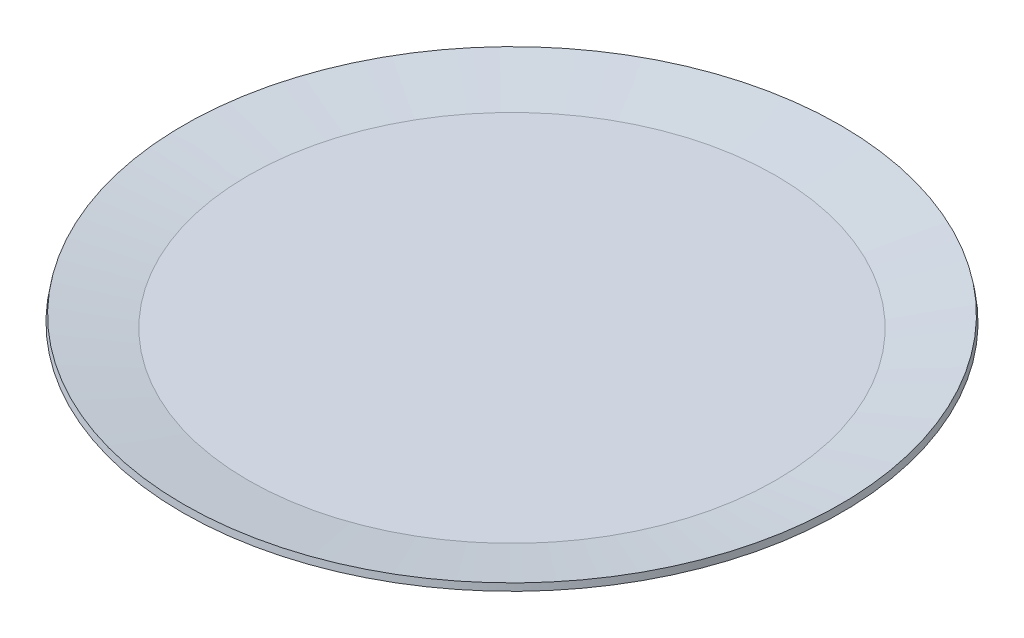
SolidWorks part; units mm, degrees
ref_plane "Front Plane" through (0, 0, 0) normal (0, 0, 1) x (1, 0, 0)
ref_plane "Top Plane" through (0, 0, 0) normal (0, 1, 0) x (1, 0, 0)
ref_plane "Right Plane" through (0, 0, 0) normal (1, 0, 0) x (0, 0, -1)
sketch "Sketch2" plane through (0, 0, 0) normal (0, 0, 1) x (1, 0, 0)
  line L0 (0, 0) -> (39.9125, 0)
  line L1 (40.0862, 0.0152) -> (49.8481, 1.7365)
  line L2 (0, 1) -> (39.9125, 1)
  line L3 (39.9125, 1) -> (49.6744, 2.7213)
  line L4 (0, 1) -> (0, 0)
  line L5 (49.6744, 2.7213) -> (49.8481, 1.7365)
  arc A0 (40.0862, 0.0152) -> (39.9125, 0) centre (39.9125, 1) cw
  arc A1 (39.9125, 1) -> (39.9125, 1) centre (39.9125, 1) cw
  point P6 (40, 0)
  dimension "D4" = 1
  dimension "D1" = 40
  dimension "D2" = 10
  dimension "D3" = 190
  dimension "D5" = 1
revolve "Revolve1" add sketch "Sketch2" angle 360 about L4
